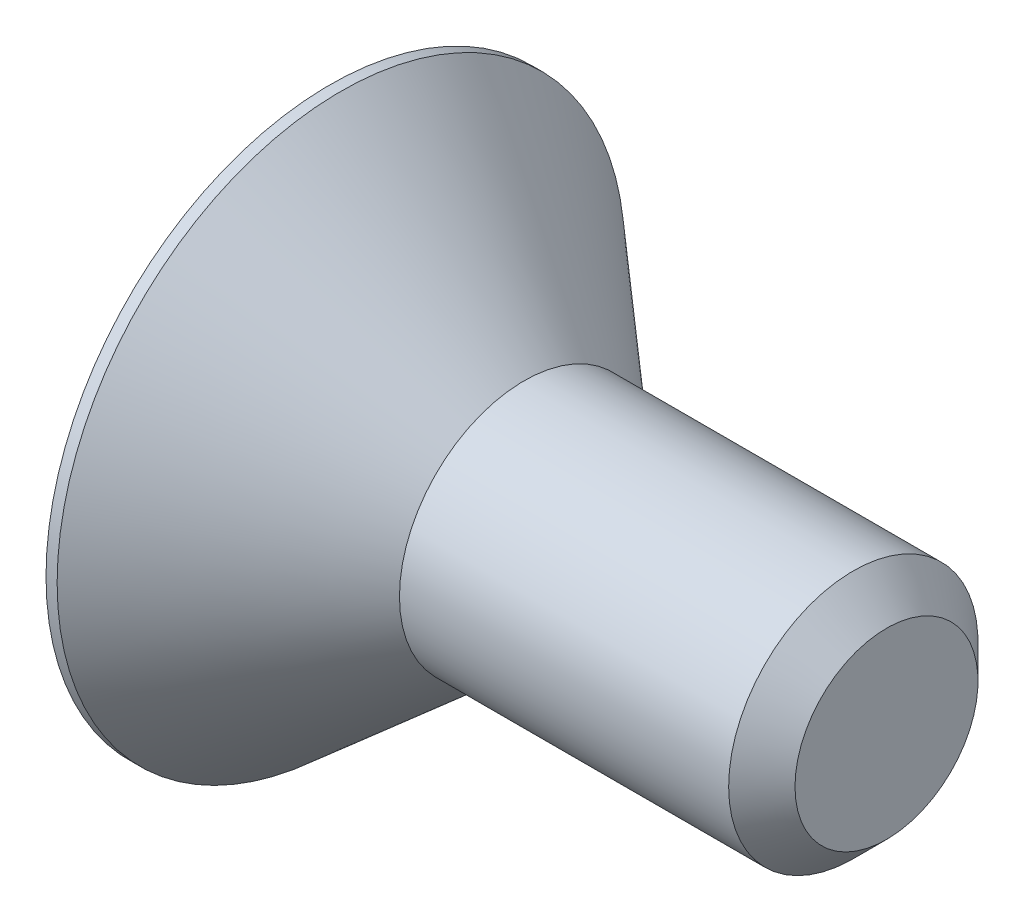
SolidWorks part; units mm, degrees
ref_plane "Plane1" through (0, 0, 0) normal (0, 0, 1) x (1, 0, 0)
ref_plane "Plane2" through (0, 0, 0) normal (0, 1, 0) x (1, 0, 0)
ref_plane "Plane3" through (0, 0, 0) normal (1, 0, 0) x (0, 0, -1)
sketch "BodySke" plane through (0, 0, 0) normal (0, 0, 1) x (1, 0, 0)
  line L0 (0, 0) -> (0, 3.2385)
  line L1 (0.127, 3.2385) -> (2.2162, 1.4224)
  line L2 (0, 3.2385) -> (0.127, 3.2385)
  line L3 (2.2162, 1.4224) -> (5.9715, 1.4224)
  line L4 (6.35, 1.0439) -> (6.35, 0)
  line L5 (6.35, 0) -> (0, 0)
  line L6 (0, 0) -> (127, 0) construction
  line L7 (0.127, -3.2385) -> (2.2162, -1.4224) construction
  line L8 (6.35, 1.0439) -> (5.9715, 1.4224)
  line L9 (0, -3.2385) -> (0.127, -3.2385) construction
  line L10 (6.35, -1.0439) -> (5.9715, -1.4224) construction
  line L11 (2.8512, 7.7724) -> (2.8512, -14.4526) construction
  line L12 (0, 8.6639) -> (0, -13.5611) construction
  dimension "D1" = 0.127
  dimension "Diameter" = 2.8448
  dimension "Length" = 6.35
  dimension "Body_ch_ang" = 45
  dimension "Head_dia" = 6.477
  dimension "Minor_dia" = 2.0879
  dimension "Head_ang" = 82
  dimension "Advance" = 0.635
  dimension "Thread_nom" = 6.35
revolve "BaseBody" add sketch "BodySke" angle 360 about L6
sketch "Sketch2" plane through (0, 0, 0) normal (0, 0, 1) x (1, 0, 0)
  line L0 (0, 0.7937) -> (1.397, 0.7937)
  line L1 (1.397, 0.7937) -> (1.8553, 0)
  line L2 (0, 0) -> (127, 0) construction
  line L3 (1.8553, 0) -> (0, 0)
  line L4 (0, 0) -> (0, 0.7937)
  line L5 (0, -0.7937) -> (1.397, -0.7937) construction
  line L6 (0, 0) -> (47.625, 0) construction
  line L8 (0, 3.2385) -> (0, -3.2385) construction
  dimension "D2" = 60
  dimension "PreBroach_depth" = 1.397
  dimension "PreBroach_dia" = 1.5875
revolve "PreBroach" cut sketch "Sketch2" angle 360 about L6
sketch "Sketch3" plane through (0, 0, 0) normal (-1, 0, 0) x (0, 0, 1)
  line L0 (-0.7938, -0.4583) -> (-0.7938, 0.4583)
  line L1 (-0.7938, 0.4583) -> (0, 0.9165)
  line L2 (0, 0.9165) -> (0.7937, 0.4583)
  line L3 (0.7937, 0.4583) -> (0.7937, -0.4583)
  line L4 (0.7937, -0.4583) -> (0, -0.9165)
  line L5 (0, -0.9165) -> (-0.7938, -0.4583)
  dimension "D1" = 0.7937
  dimension "D2" = 0.7937
  dimension "D3" = 1.5875
  dimension "Hex_size" = 1.5875
extrude "Hex" cut sketch "Sketch3" against normal blind 1.397
sketch "Sketch4" plane through (0, 0, 0) normal (-1, 0, 0) x (0, 0, 1)
  line L0 (0, 0) -> (0.9398, 0)
  line L1 (0, 0) -> (6.1484, 3.5498) construction
  line L2 (0, 0) -> (0.4699, 0.8139)
  line L3 (0.7832, 0.2175) -> (0.8962, 0.2828)
  line L4 (0.58, 0.5695) -> (0.693, 0.6348)
  arc A0 (0.7832, 0.2175) -> (0.58, 0.5695) centre (0, 0) ccw
  arc A1 (0.9398, 0) -> (0.8962, 0.2828) centre (0, 0) ccw
  arc A2 (0.4699, 0.8139) -> (0.693, 0.6348) centre (0, 0) cw
  dimension "D1" = 30
  dimension "Spline_n_dim" = 1.6256
  dimension "Spline_m_dim" = 1.8796
  dimension "D2" = 60
  dimension "D3" = 0.2032
  dimension "Spline_p_dim" = 0.4064
extrude "Spline" [suppressed] cut sketch "Sketch4" against normal blind 1.397
pattern_circular "CirPattern1" [suppressed] count 6 every 60 about axis through (0, 0, 0) along (1, 0, 0)
sketch "ThdSchSke" plane through (0, 0, 0) normal (0, 0, 1) x (1, 0, 0)
  line L0 (2.7242, -1.0439) -> (2.4592, -1.4224)
  line L1 (2.7242, -1.0439) -> (2.9892, -1.4224)
  line L2 (2.9892, -1.4224) -> (2.9892, -1.778)
  line L3 (-3.175, 0) -> (5.1513, 0) construction
  line L4 (0, 3.2385) -> (0, -3.2385) construction
  line L5 (2.9892, -1.778) -> (2.4592, -1.778)
  line L6 (2.4592, -1.778) -> (2.4592, -1.4224)
  dimension "Thread_minor" = 2.0879
  dimension "Diameter" = 2.8448
  dimension "Start" = 2.7242
  dimension "SideAngle" = 55
  dimension "VeeAngle" = 70
  dimension "Overcut" = 3.556
revolve "ThreadSchematic" [suppressed] cut sketch "ThdSchSke" angle 360 about L3
pattern_linear "ThdSchPat" [suppressed]
equation "\"D3@Sketch4\" = \"Spline_p_dim@Sketch4\" / 2"
equation "\"Thread_minor@ThreadCosmetic\"  =  \"Minor_dia@BodySke\""
equation "\"D2@CirPattern1\" = 360 / \"Num_teeth@CirPattern1\""
equation "\"D1@Sketch3\" = \"Hex_size@Sketch3\" / 2"
equation "\"D2@Sketch3\" = \"D1@Sketch3\""
equation "\"D3@Sketch3\" = \"Hex_size@Sketch3\""
equation "\"Thread_length@ThreadCosmetic\" = ((sgn( (\"Length@BodySke\" - \"Advance@BodySke\" - ( ( ( \"Head_dia@BodySke\" - \"Diameter@BodySke\" ) * 0.5 ) / tan( \"Head_ang@BodySke\" * 0.008726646 ) ) ) - \"Thread_nom@Body"
equation "\"Thread_minor@ThdSchSke\" = \"Minor_dia@BodySke\""
equation "\"Diameter@ThdSchSke\" = \"Diameter@BodySke\""
equation "\"Overcut@ThdSchSke\" = \"Diameter@BodySke\" * 1.25"
equation "\"Start@ThdSchSke\" = 0.000001 + \"Length@BodySke\" - \"Thread_length@ThreadCosmetic\"  '---Countersunk---"
equation "\"Num_threads@ThdSchPat\" = int( \"Thread_length@ThreadCosmetic\" / \"Advance@BodySke\" + 0.999 )  + 1"
equation "\"Advance@ThdSchPat\" = \"Thread_length@ThreadCosmetic\" /  (\"Num_threads@ThdSchPat\" - 1) 'relax it"
equation "\"Num_threads@ThdSchPat\" = \"Num_threads@ThdSchPat\" - sgn( \"Num_threads@ThdSchPat\" - 1) '---chamfered tips only---"
